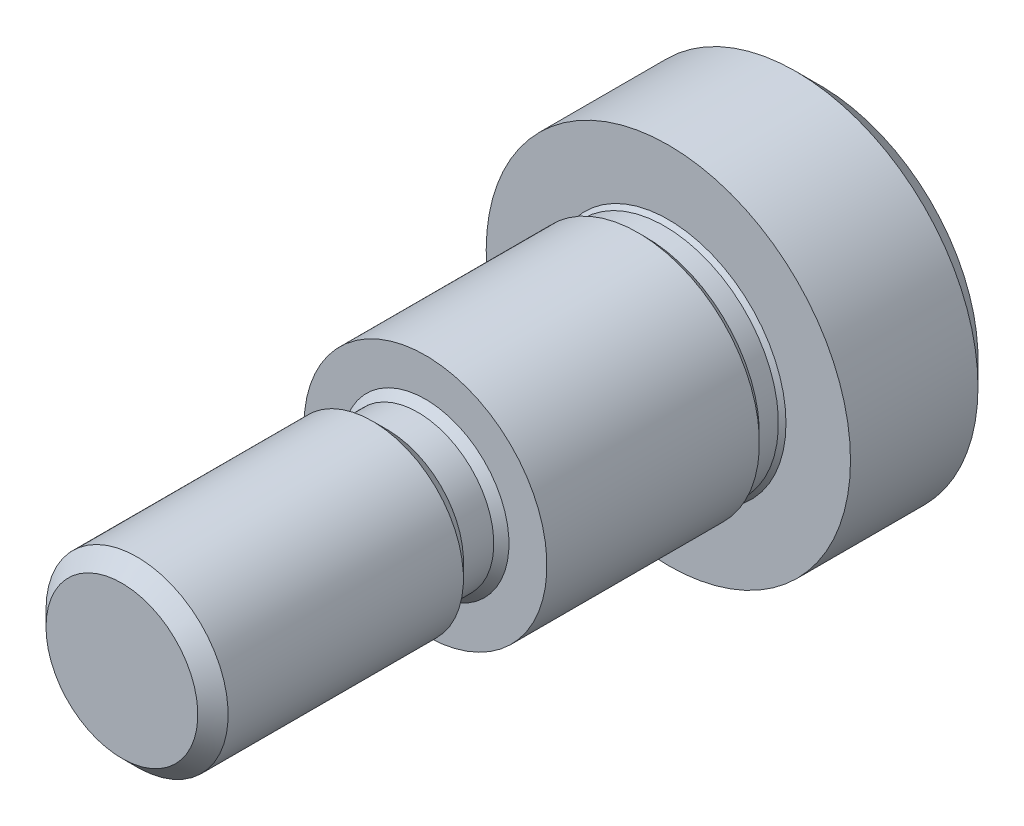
SolidWorks part; units mm, degrees
ref_plane "Front" through (0, 0, 0) normal (0, 0, 1) x (1, 0, 0)
ref_plane "Top" through (0, 0, 0) normal (0, 1, 0) x (1, 0, 0)
ref_plane "Right" through (0, 0, 0) normal (1, 0, 0) x (0, 0, -1)
sketch "Logo3_Revol_Axis" plane through (0, 0, 0) normal (0, 1, 0) x (1, 0, 0)
  line L0 (0, -25.3777) -> (0, 25.3777) construction
sketch "Logo3_bib1" plane through (0, 0, 0) normal (0, -1, 0) x (-1, 0, 0)
  line L0 (0, 62.3527) -> (0, -65.5595) construction
  line L1 (6.35, 0) -> (4.3656, 0)
  line L2 (6.35, 0) -> (6.35, 11.1125)
  line L3 (6.35, 11.1125) -> (5.9531, 11.5094)
  line L4 (9.525, 19.3675) -> (8.255, 20.6375)
  line L5 (6.1516, 12.7) -> (9.525, 12.7)
  line L6 (9.525, 12.7) -> (9.525, 19.3675)
  line L7 (8.255, 20.6375) -> (0, 20.6375)
  line L8 (5.9531, 11.5094) -> (5.9531, 12.5016)
  line L9 (4.7625, -2.7781) -> (4.7625, -15.0812)
  line L11 (4.7625, -15.0812) -> (3.9688, -15.875)
  line L12 (3.9688, -15.875) -> (0, -15.875)
  line L13 (0, -15.875) -> (0, 20.6375)
  line L14 (3.9688, -0.3969) -> (3.9688, -1.9844)
  line L15 (3.9688, -1.9844) -> (4.7625, -2.7781)
  line L16 (5.9531, 12.5016) -> (6.1516, 12.7)
  line L17 (3.9688, -0.3969) -> (4.3656, 0)
  point P18 (9.525, 20.6375)
revolve "Revolve1" add sketch "Logo3_bib1" angle 360 about L0
sketch "Logo3_bib2" plane through (0, 0, -20.6375) normal (0, 0, -1) x (1, 0, 0)
  line L1 (3.6662, 0) -> (1.8331, 3.175)
  line L2 (1.8331, 3.175) -> (-1.8331, 3.175)
  line L3 (-1.8331, 3.175) -> (-3.6662, 0)
  line L4 (-3.6662, 0) -> (-1.8331, -3.175)
  line L5 (-1.8331, -3.175) -> (1.8331, -3.175)
  line L6 (1.8331, -3.175) -> (3.6662, 0)
  circle A0 centre (0, 0) radius 3.175 construction
  dimension "Logo3_c1" = 6.35
extrude "Cut-Extrude1" cut sketch "Logo3_bib2" against normal blind 5.2917
equation "\"D2@Cosmetic Thread1\" = \"Logo3_dm-pas@Logo3_bib1\""
